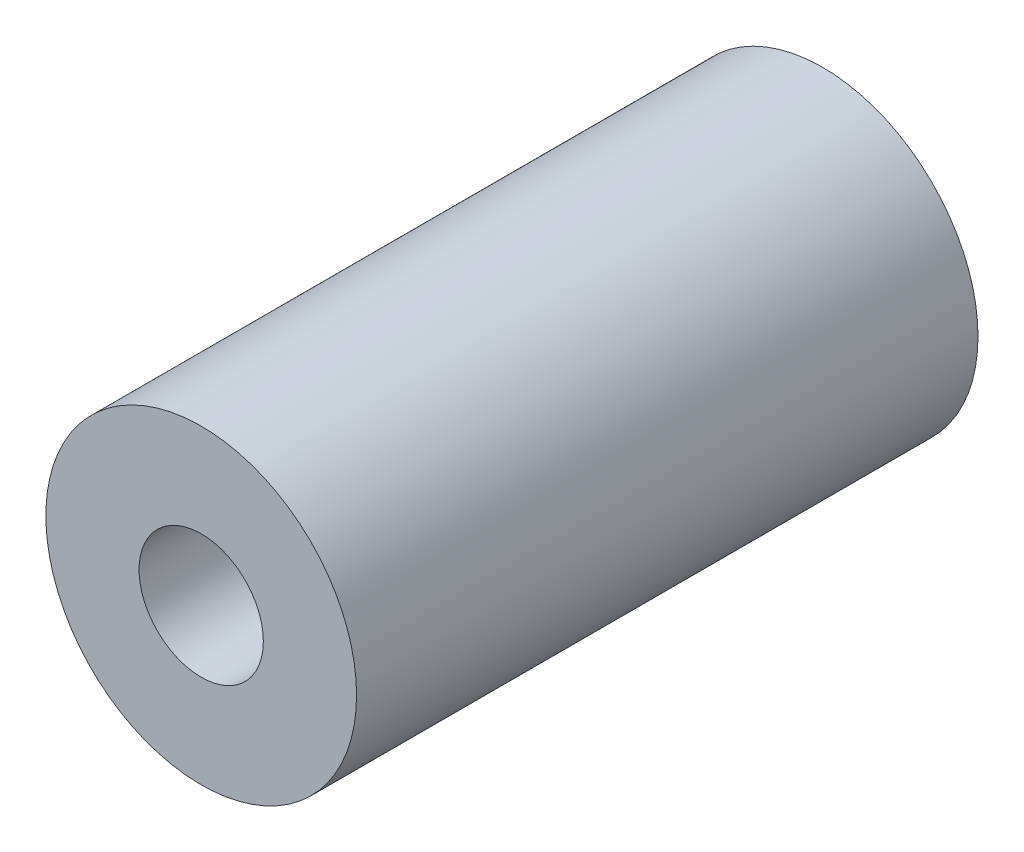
SolidWorks part; units mm, degrees
ref_plane "Plan de face" through (0, 0, 0) normal (0, 0, 1) x (1, 0, 0)
ref_plane "Plan de dessus" through (0, 0, 0) normal (0, 1, 0) x (1, 0, 0)
ref_plane "Plan de droite" through (0, 0, 0) normal (1, 0, 0) x (0, 0, -1)
sketch "Esquisse1" plane through (0, 0, 0) normal (0, 0, 1) x (1, 0, 0)
  circle A0 centre (0, 0) radius 2
  circle A1 centre (0, 0) radius 5
  dimension "D1" = 4
  dimension "D2" = 10
extrude "Extrusion1" add sketch "Esquisse1" along normal blind 20
ref_plane "Plan1" through (0, 0, 0) normal (0, 1, 0) x (-1, 0, 0)
sketch "Esquisse6" plane through (0, 0, 0) normal (0, 1, 0) x (-1, 0, 0)
  line L0 (-5, 0) -> (5, 0) construction
  line L1 (5, 20) -> (-5, 20) construction
  circle A0 centre (0, 15) radius 1.5
  circle A1 centre (0, 5) radius 1.5
  dimension "D3" = 3
  dimension "D4" = 3
  dimension "D1" = 5
  dimension "D2" = 5
extrude "Enlèv. mat.-Extru.1" cut sketch "Esquisse6" against normal blind 20
